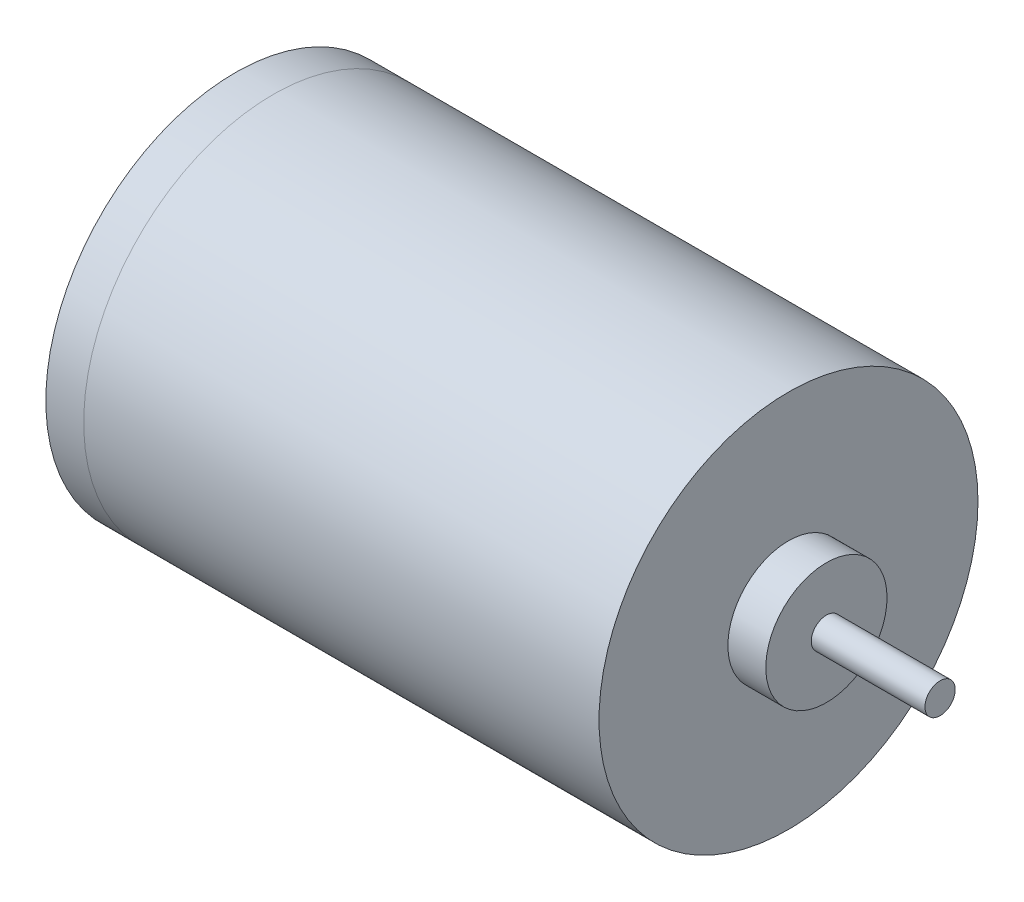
SolidWorks part; units mm, degrees
ref_plane "Front Plane" through (0, 0, 0) normal (0, 0, 1) x (1, 0, 0)
ref_plane "Top Plane" through (0, 0, 0) normal (0, 1, 0) x (1, 0, 0)
ref_plane "Right Plane" through (0, 0, 0) normal (1, 0, 0) x (0, 0, -1)
sketch "Sketch1" plane through (0, 0, 0) normal (1, 0, 0) x (0, 0, -1)
  circle A0 centre (0, 0) radius 12.5
  dimension "D1" = 25
extrude "Boss-Extrude1" add sketch "Sketch1" along normal blind 2.5
sketch "Sketch3" plane through (2.5, 0, 0) normal (1, 0, 0) x (0, 0, -1)
  circle A0 centre (0, 0) radius 12.501
  circle A1 centre (0, 0) radius 12.5 construction
  dimension "D1" = 0.001
extrude "Boss-Extrude3" add sketch "Sketch3" along normal blind 34
sketch "Sketch4" plane through (36.5, 0, 0) normal (1, 0, 0) x (0, 0, -1)
  circle A0 centre (0, 0) radius 4
  dimension "D1" = 8
extrude "Boss-Extrude4" add sketch "Sketch4" along normal blind 2.5
sketch "Sketch5" plane through (39, 0, 0) normal (1, 0, 0) x (0, 0, -1)
  circle A0 centre (0, 0) radius 1
  dimension "D1" = 2
extrude "Boss-Extrude5" add sketch "Sketch5" along normal blind 7.5
ref_plane "Plane1" through (0, 0, 10) normal (0, 0, 1) x (1, 0, 0)
